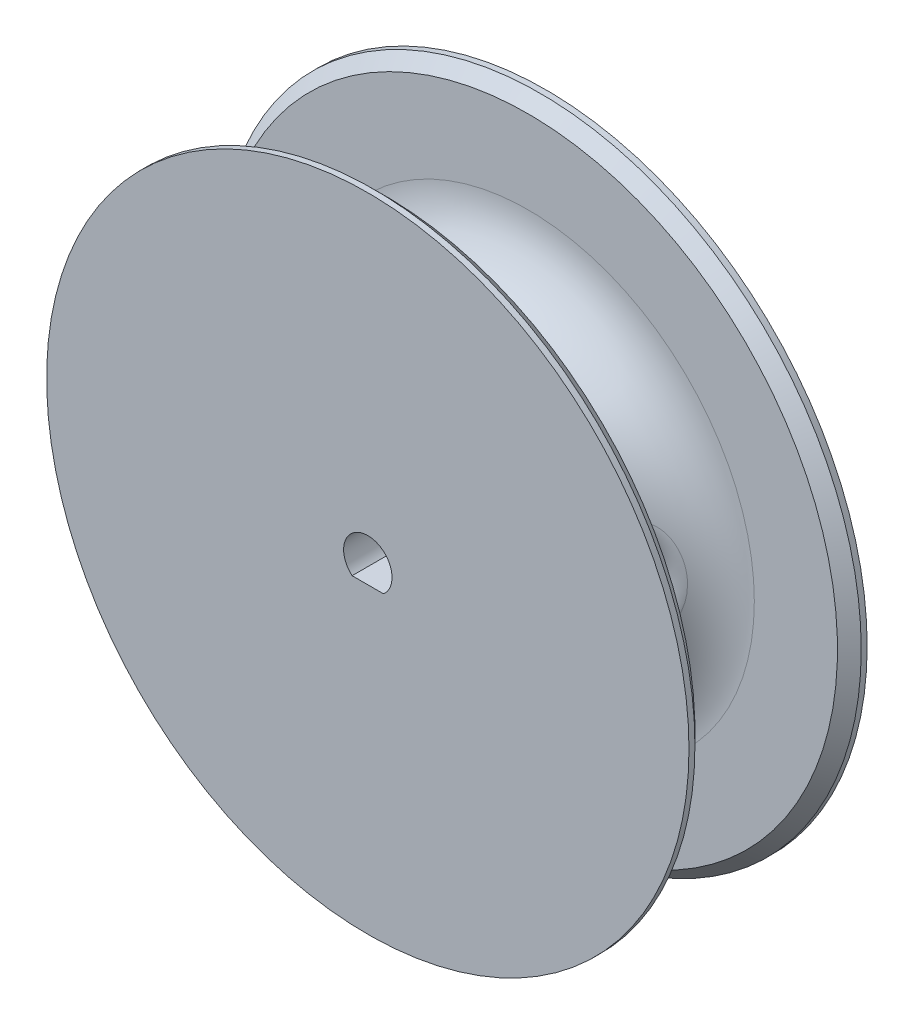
SolidWorks part; units mm, degrees
ref_plane "Front Plane" through (0, 0, 0) normal (0, 0, 1) x (1, 0, 0)
ref_plane "Top Plane" through (0, 0, 0) normal (0, 1, 0) x (1, 0, 0)
ref_plane "Right Plane" through (0, 0, 0) normal (1, 0, 0) x (0, 0, -1)
sketch "Sketch1" plane through (0, 0, 0) normal (0, 1, 0) x (1, 0, 0)
  line L0 (0, 0) -> (0, 15) construction
  line L1 (4.075, -15) -> (54.075, -15)
  line L2 (4.075, -15) -> (4.075, 15)
  line L3 (4.075, 15) -> (54.075, 15)
  line L4 (54.075, -15) -> (54.075, 15)
  line L5 (54.075, 12) -> (38.075, 12)
  line L6 (54.075, 12) -> (54.075, -12)
  line L7 (54.075, -12) -> (38.075, -12)
  line L8 (38.075, 12) -> (38.075, -12)
  circle A0 centre (38.075, 0) radius 12
  dimension "D1" = 30
  dimension "D2" = 4.075
  dimension "D3" = 50
  dimension "D4" = 3
  dimension "D5" = 3
  dimension "D6" = 16
revolve "main pulley body" add sketch "Sketch1" angle 360 about L0
chamfer "shaping pulley for line" distance 2 angle 45 2 edges at (54.075, 0, 12) (54.075, 0, -12)
sketch "Sketch4" plane through (0, 0, 15) normal (0, 0, 1) x (1, 0, 0)
  line L1 (4, -3.1) -> (-4, -3.1)
  line L2 (4, -3.1) -> (4, -5.1)
  line L3 (4, -5.1) -> (-4, -5.1)
  line L4 (-4, -3.1) -> (-4, -5.1)
  point P4 (0, -3.1)
  dimension "D1" = 3.1
  dimension "D2" = 2
extrude "d-shaft" add sketch "Sketch4" against normal up to surface (30 mm away)
ref_plane "starting for line hole" through (33.5, 0, 0) normal (1, 0, 0) x (0, 0, -1)
sketch "Sketch6" plane through (33.5, 0, 0) normal (1, 0, 0) x (0, 0, -1)
  line L0 (15.8078, 59.3114) -> (15.8078, -59.4078) construction
  circle A0 centre (0.8078, 0) radius 3
  dimension "D1" = 15
revolve "line hole" cut sketch "Sketch6" angle 90 about L0
fillet "ounding line hole" radius 4.5 1 edges at (26.0126, 1.8096, -0.1092)
